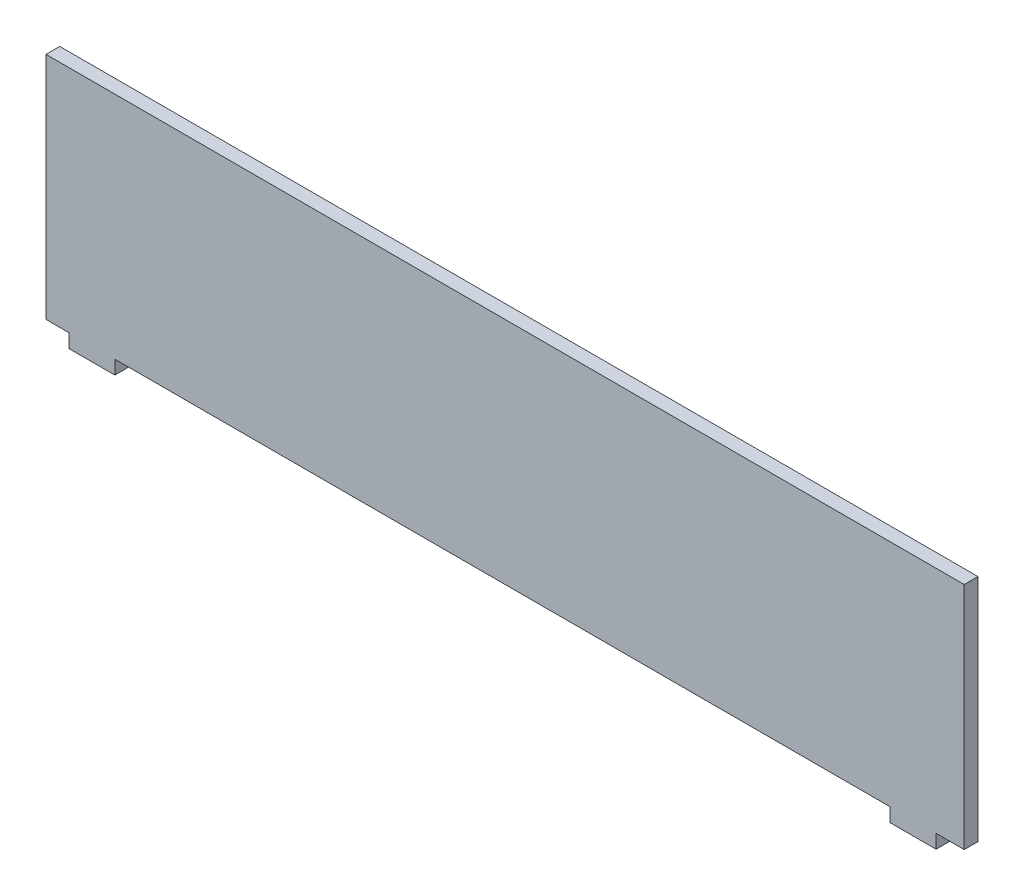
SolidWorks part; units mm, degrees
ref_plane "Plano frontal" through (0, 0, 0) normal (0, 0, 1) x (1, 0, 0)
ref_plane "Plano superior" through (0, 0, 0) normal (0, 1, 0) x (1, 0, 0)
ref_plane "Plano direito" through (0, 0, 0) normal (1, 0, 0) x (0, 0, -1)
sketch "Esboço2" plane through (0, 0, 0) normal (0, 0, 1) x (1, 0, 0)
  line L0 (-62.4907, 33.1346) -> (137.5093, 33.1346)
  line L1 (137.5093, 33.1346) -> (137.5093, -16.8654)
  line L3 (-62.4907, -16.8654) -> (-62.4907, 33.1346)
  line L4 (-62.4907, -16.8654) -> (-57.4907, -16.8654)
  line L5 (-57.4907, -16.8654) -> (-57.4907, -19.8654)
  line L6 (-57.4907, -19.8654) -> (-47.4907, -19.8654)
  line L7 (-47.4907, -19.8654) -> (-47.4907, -16.8654)
  line L8 (137.5093, -16.8654) -> (131.3793, -16.8654)
  line L9 (131.3793, -16.8654) -> (131.3793, -19.8654)
  line L10 (131.3793, -19.8654) -> (121.3793, -19.8654)
  line L11 (121.3793, -19.8654) -> (121.3793, -16.8654)
  line L12 (-47.4907, -16.8654) -> (121.3793, -16.8654)
extrude "Ressalto-extrusão1" add sketch "Esboço2" along normal blind 3
